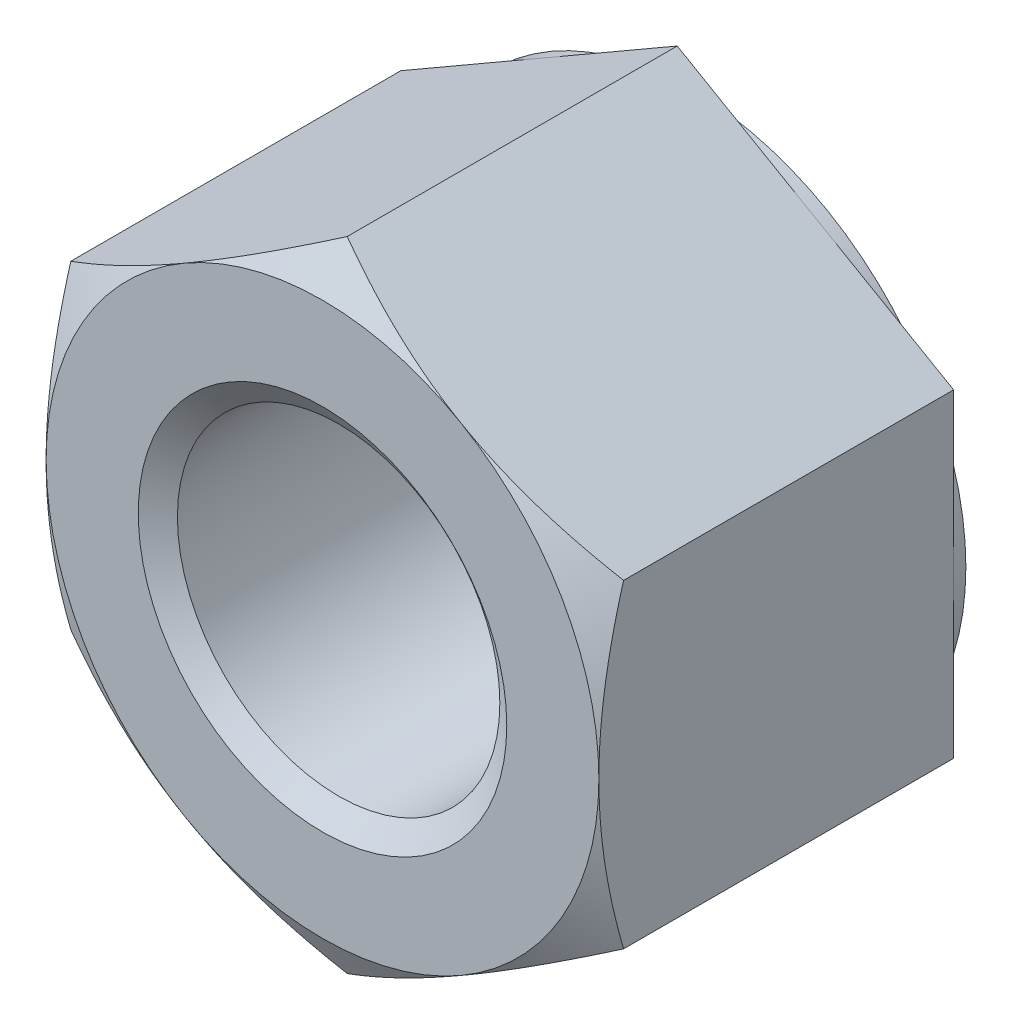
SolidWorks part; units mm, degrees
ref_plane "Plane1" through (0, 0, 0) normal (0, 0, 1) x (1, 0, 0)
ref_plane "Plane2" through (0, 0, 0) normal (0, 1, 0) x (1, 0, 0)
ref_plane "Plane3" through (0, 0, 0) normal (1, 0, 0) x (0, 0, -1)
sketch "BaseNutSke" plane through (0, 0, 0) normal (0, 0, 1) x (1, 0, 0)
  line L6 (18, 10.3923) -> (18, -10.3923)
  line L7 (-18, 10.3923) -> (-18, -10.3923)
  line L8 (18, 10.3923) -> (0, 20.7846)
  line L9 (0, 20.7846) -> (-18, 10.3923)
  line L10 (-18, -10.3923) -> (0, -20.7846)
  line L11 (0, -20.7846) -> (18, -10.3923)
  circle A0 centre (0, 0) radius 10.5
  dimension "D4" = 18
  dimension "Tap_drill" = 21
  dimension "D1" = 120
  dimension "D2" = 18
  dimension "D3" = 18
  dimension "Width_flats" = 36
extrude "BaseNut" add sketch "BaseNutSke" against normal blind 23.9
sketch "Sketch4" plane through (0, 0, 0) normal (1, 0, 0) x (0, 0, -1)
  line L0 (23.9, 18) -> (23.1, 18)
  line L1 (23.9, 18) -> (23.9, 30.7846)
  line L2 (23.1, 30.7846) -> (23.9, 30.7846)
  line L3 (23.1, 30.7846) -> (23.1, 18)
  line L4 (0, 0) -> (34.925, 0) construction
  line L6 (23.9, 10.3923) -> (23.9, 20.7846) construction
  line L7 (0, 18) -> (-10, 18)
  line L8 (0, 10.3923) -> (0, 20.7846) construction
  line L9 (1.6077, 20.7846) -> (1.6077, 30.7846)
  line L10 (1.6077, 30.7846) -> (-10, 30.7846)
  line L11 (-10, 30.7846) -> (-10, 18)
  line L12 (0, 18) -> (1.6077, 20.7846)
  line L14 (0, 10.3923) -> (0, -10.3923) construction
  line L15 (23.9, 20.7846) -> (0, 20.7846) construction
  dimension "D1" = 18
  dimension "D2" = 30
  dimension "Bearing_ht" = 0.8
  dimension "D3" = 10
  dimension "D4" = 10
revolve "Bearing-Face" cut sketch "Sketch4" angle 360 about L4
sketch "Sketch3" plane through (0, 0, 0) normal (1, 0, 0) x (0, 0, -1)
  line L0 (23.9, 18) -> (22.2923, 20.7846)
  line L1 (22.2923, 20.7846) -> (22.2923, 30.7846)
  line L2 (22.2923, 30.7846) -> (33.9, 30.7846)
  line L3 (33.9, 30.7846) -> (33.9, 18)
  line L4 (33.9, 18) -> (23.9, 18)
  line L5 (23.9, 10.3923) -> (23.9, 20.7846) construction
  line L6 (23.1, 20.7846) -> (1.6077, 20.7846) construction
  line L7 (0, 0) -> (38.6776, 0) construction
  line L8 (23.9, 0) -> (0, 0) construction
  line L9 (12.3538, 20.7846) -> (12.3538, 44.222) construction
  line L10 (2.4154, 30.7846) -> (-9.1923, 30.7846)
  line L11 (-9.1923, 30.7846) -> (-9.1923, 18)
  line L12 (-9.1923, 18) -> (0.8077, 18)
  line L13 (0.8077, 18) -> (2.4154, 20.7846)
  line L14 (2.4154, 20.7846) -> (2.4154, 30.7846)
  line L15 (23.1, 20.7846) -> (1.6077, 20.7846) construction
  line L16 (23.1, 20.7846) -> (1.6077, 20.7846) construction
  dimension "D1" = 18
  dimension "D2" = 30
  dimension "D3" = 10
  dimension "D4" = 10
revolve "Double-Chamfer" [suppressed] cut sketch "Sketch3" angle 360 about L7
sketch "Sketch5"
  line L0 (23.9, 12) -> (22.8497, 10.5)
  line L2 (23.9, 12) -> (23.9, 10.5)
  line L3 (23.9, 10.5) -> (22.8497, 10.5)
  line L7 (0, 12) -> (1.0503, 10.5)
  line L9 (1.0503, 10.5) -> (0, 10.5)
  line L10 (0, 10.5) -> (0, 12)
  line L11 (25.0375, 0) -> (38.388, 0) construction
  line L12 (23.9, 0) -> (0, 0) construction
revolve "ThreadSchematic" cut sketch "ThdSchSke" angle 360 about L6
sketch "ThdSchSke" plane through (0, 0, 0) normal (0, 1, 0) x (1, 0, 0)
  line L0 (-12, 2.1006) -> (-10.5, 3.1509)
  line L1 (-10.5, 3.1509) -> (-6, 3.1509)
  line L2 (-6, 3.1509) -> (-6, 1.0503)
  line L3 (-6, 1.0503) -> (-10.5, 1.0503)
  line L4 (-10.5, 1.0503) -> (-12, 2.1006)
  line L5 (-3.175, 3) -> (3.175, 3) construction
  line L6 (0, 3) -> (0, -2.9874) construction
  line L7 (0, 22.8497) -> (0, 1.0503) construction
  dimension "VeeAngle" = 70
  dimension "SideAngle" = 55
  dimension "OverCut" = 12
  dimension "Advance" = 3
  dimension "Thread_major" = 24
revolve "EndChamfer" cut sketch "Sketch5" angle 360 about L11
pattern_linear "ThdSchPat" [suppressed] count 7 spacing 3
equation "\"D2@BaseNutSke\" = \"Width_flats@BaseNutSke\" / 2"
equation "\"D3@BaseNutSke\" = \"Width_flats@BaseNutSke\" / 2"
equation "\"D1@Sketch3\" = \"Width_flats@BaseNutSke\" /2"
equation "\"D1@Sketch4\" = \"D2@BaseNutSke\""
equation "\"D4@BaseNutSke\" = \"D3@BaseNutSke\""
equation "\"Thread_major@ThdSchSke\" = \"Thread_major@ThreadCosmetic\""
equation "\"Overcut@ThdSchSke\" = \"Thread_major@ThdSchSke\" / 2"
equation "' \"Num_threads@ThdSchPat\" = \"Num_threads@ThdSchPat\" - sgn( \"Num_threads@ThdSchPat\" - 1) '---chamfered tips only---"
equation "\"ThreadMajor@Sketch5\" = \"Thread_major@ThreadCosmetic\" * 0.5"
equation "\"D3@ThdSchPat\" = \"Advance@ThdSchSke\""
equation "\"D1@ThdSchPat\" =  int( \"Thickness@BaseNut\" / \"Advance@ThdSchSke\" ) "
